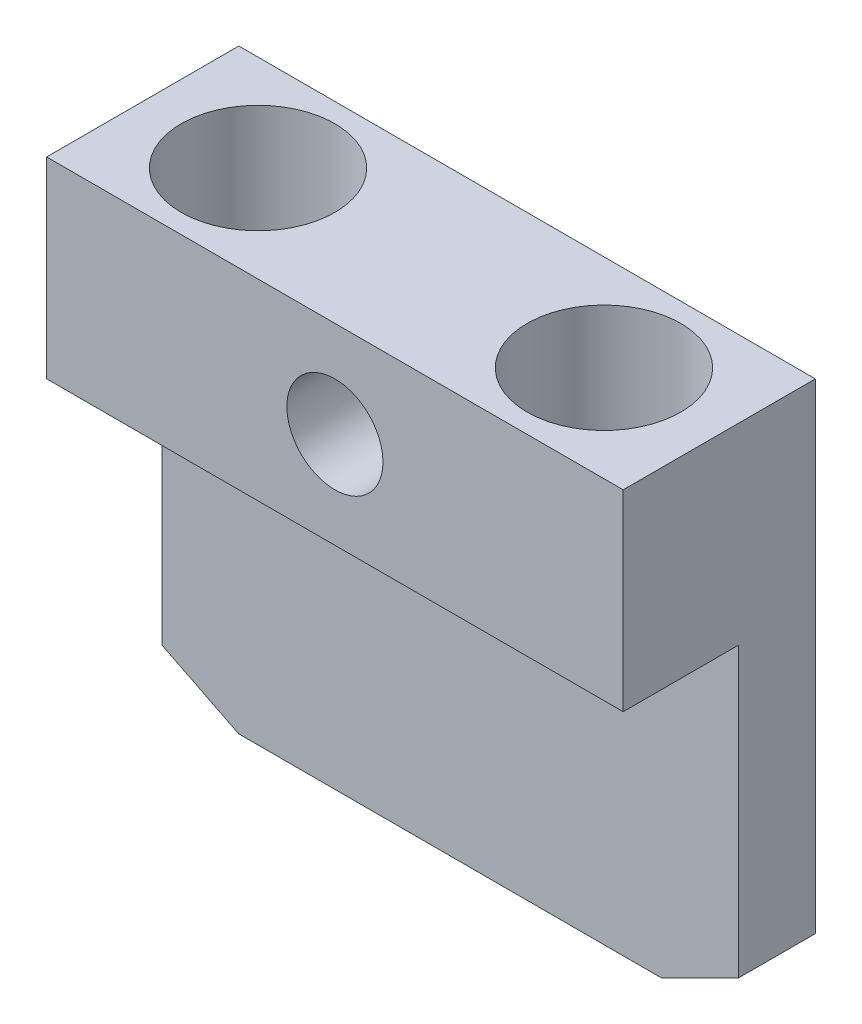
SolidWorks part; units mm, degrees
ref_plane "前视基准面" through (0, 0, 0) normal (0, 0, 1) x (1, 0, 0)
ref_plane "上视基准面" through (0, 0, 0) normal (0, 1, 0) x (1, 0, 0)
ref_plane "右视基准面" through (0, 0, 0) normal (1, 0, 0) x (0, 0, -1)
sketch "草图1" plane through (0, 0, 0) normal (0, 0, 1) x (1, 0, 0)
  line L0 (0, 1) -> (0, 13.5)
  line L1 (15, 1) -> (15, 13.5)
  line L2 (2, 0) -> (13, 0)
  line L3 (0, 13.5) -> (15, 13.5)
  line L4 (2, 0) -> (0, 1)
  line L5 (13, 0) -> (15, 1)
  circle A0 centre (7.5, 11) radius 1.25
extrude "凸台-拉伸1" add sketch "草图1" along normal blind 5
sketch "草图2" plane through (15, 0, 0) normal (1, 0, 0) x (0, 0, -1)
  line L0 (-5, 8.5) -> (-2, 8.5)
  line L1 (-2, 0) -> (-2, 8.5)
extrude "切除-拉伸1" cut sketch "草图2" against normal through all and the other way through all
sketch "草图3" plane through (0, 13.5, 0) normal (0, 1, 0) x (1, 0, 0)
  circle A0 centre (12, -2.5) radius 2
  circle A1 centre (3, -2.5) radius 2
extrude "切除-拉伸2" cut sketch "草图3" against normal blind 3
